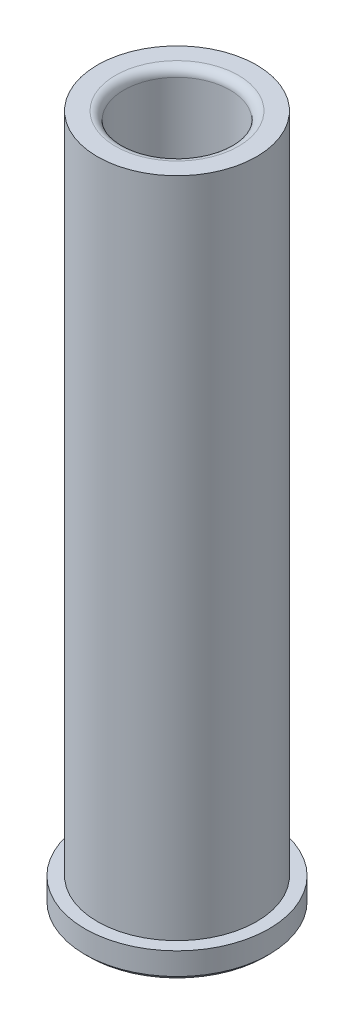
SolidWorks part; units mm, degrees
ref_plane "Front Plane" through (0, 0, 0) normal (0, 0, 1) x (1, 0, 0)
ref_plane "Top Plane" through (0, 0, 0) normal (0, 1, 0) x (1, 0, 0)
ref_plane "Right Plane" through (0, 0, 0) normal (1, 0, 0) x (0, 0, -1)
sketch "Sketch1" plane through (0, 0, 0) normal (0, 0, 1) x (1, 0, 0)
  line L0 (-15.7734, 0) -> (-16.5354, 0.762)
  line L1 (0, -1000) -> (0, 49000) construction
  line L2 (-9.5314, 123.825) -> (-9.5313, 0.762)
  line L3 (-10.2933, 0) -> (-15.7734, 0)
  line L4 (-16.5354, 0.762) -> (-16.5354, 4.7625)
  line L5 (-16.5354, 4.7625) -> (-14.2938, 4.7625)
  line L6 (-14.2939, 123.825) -> (-14.2938, 4.7625)
  line L7 (-14.2939, 123.825) -> (-9.5314, 123.825)
  line L8 (-10.2933, 0) -> (-9.5313, 0.762)
  dimension "OD" = 28.5877
  dimension "ID" = 19.0627
  dimension "H" = 33.0708
  dimension "D2" = 45
  dimension "OVERALL LENGTH" = 123.825
  dimension "D4" = 0.762
  dimension "D5" = 135
  dimension "T" = 4.7625
revolve "Revolve1" add sketch "Sketch1" angle 360 about L1
fillet "Fillet1" radius 1.524 1 edges at (9.5313, 123.825, 0)
